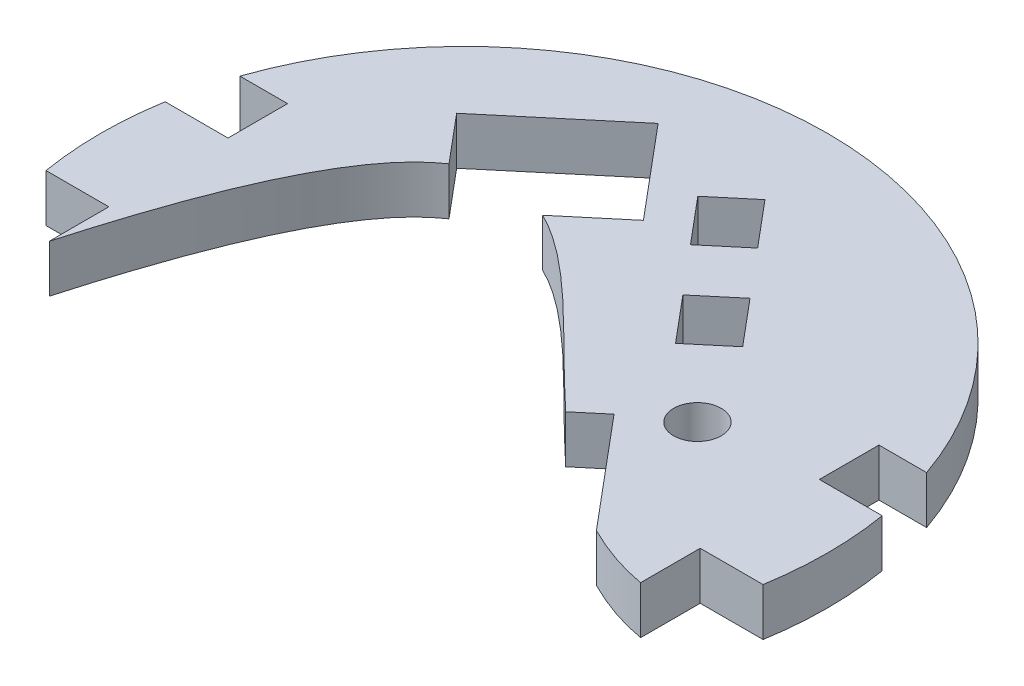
SolidWorks part; units mm, degrees
ref_plane "Alzado" through (0, 0, 0) normal (0, 0, 1) x (1, 0, 0)
ref_plane "Planta" through (0, 0, 0) normal (0, 1, 0) x (1, 0, 0)
ref_plane "Vista lateral" through (0, 0, 0) normal (1, 0, 0) x (0, 0, -1)
sketch "Croquis1" plane through (0, 0, 0) normal (0, 1, 0) x (1, 0, 0)
  circle A0 centre (0, 0) radius 30.5
extrude "Saliente-Extruir1" add sketch "Croquis1" along normal blind 4
sketch "Croquis2" plane through (0, 4, 0) normal (0, 1, 0) x (1, 0, 0)
  circle A0 centre (0, 0) radius 2
extrude "Cortar-Extruir1" cut sketch "Croquis2" against normal blind 4
sketch "Croquis5" plane through (0, 4, 0) normal (0, 1, 0) x (1, 0, 0)
  line L0 (0, 0) -> (0, 10)
  line L1 (28.8141, -5) -> (30.0874, -5)
  line L2 (28.8141, 5) -> (30.0874, 5)
  line L3 (-24.8141, 10) -> (-28.8141, 10)
  line L4 (24.8141, -5) -> (24.8141, -10)
  line L5 (-24.8141, -10) -> (-28.8141, -10)
  line L6 (24.8141, -5) -> (28.8141, -5)
  line L7 (24.8141, 5) -> (24.8141, 10)
  line L8 (-24.8141, 5) -> (-28.8141, 5)
  line L9 (-24.8141, 5) -> (-24.8141, 10)
  line L10 (-24.8141, -5) -> (-28.8141, -5)
  line L11 (-24.8141, -5) -> (-24.8141, -10)
  line L12 (24.8141, 5) -> (28.8141, 5)
  line L13 (24.8141, -10) -> (28.8141, -10)
  line L14 (24.8141, 10) -> (28.8141, 10)
  line L15 (-28.8141, 5) -> (-30.0874, 5)
  line L16 (-28.8141, -5) -> (-30.0874, -5)
  circle A1 centre (0, 0) radius 30.5 construction
  arc A2 (-28.8141, 10) -> (-30.0874, 5) centre (0, 0) ccw
  arc A3 (28.8141, 10) -> (28.8141, -10) centre (0, 0) cw
  arc A4 (-30.0874, -5) -> (-28.8141, -10) centre (0, 0) ccw
  arc A5 (30.0874, -5) -> (28.8141, -10) centre (0, 0) cw
  arc A6 (28.8141, 10) -> (30.0874, 5) centre (0, 0) cw
extrude "Cortar-Extruir3" cut sketch "Croquis5" against normal blind 4
sketch "Croquis7" plane through (0, 4, 0) normal (0, 1, 0) x (1, 0, 0)
  line L0 (-8.1011, 29.1011) -> (9.5756, 8.0348)
  line L2 (-8.1011, 29.1011) -> (-27.2522, 13.0314)
  line L3 (27.2522, -13.0314) -> (8.1011, -29.1011)
  line L4 (8.1011, -29.1011) -> (-27.2522, 13.0314)
  line L5 (2.1944, 23.0542) -> (-0.8697, 20.4831)
  line L6 (2.1944, 23.0542) -> (5.4084, 19.224)
  line L7 (5.4084, 19.224) -> (2.3442, 16.6528)
  line L8 (2.3442, 16.6528) -> (-0.8697, 20.4831)
  line L9 (-24.8141, -10) -> (-28.8141, -10)
  line L10 (24.8141, -10) -> (28.8141, -10)
  line L11 (9.5756, 8.0348) -> (18.4139, -2.4983)
  line L12 (18.4139, -2.4983) -> (27.2522, -13.0314)
  line L13 (11.4555, 1.1272) -> (19.169, -8.0653)
  line L14 (19.169, -8.0653) -> (9.9765, -15.7788)
  line L15 (9.9765, -15.7788) -> (2.263, -6.5863)
  line L16 (11.4555, 1.1272) -> (2.263, -6.5863)
  line L17 (-1.4002, 16.4481) -> (-7.8281, 24.1085)
  line L18 (-1.4002, 16.4481) -> (-10.5927, 8.7346)
  line L19 (-10.5927, 8.7346) -> (-17.0206, 16.3951)
  line L20 (-7.8281, 24.1085) -> (-17.0206, 16.3951)
  arc A1 (-28.8141, -10) -> (28.8141, -10) centre (0, 0) ccw
  circle A2 centre (15.5268, 4.0539) radius 2
  spline S0 degree 3 poles (24.8141, -10) (2.6081, -6.0995) (-10.3265, 41.1093) (-24.8141, -10) knots 0 0 0 0 1 1 1 1
  point P7 (-9.5756, -8.0348)
extrude "Cortar-Extruir5" cut sketch "Croquis7" against normal blind 4
sketch "Croquis9" plane through (0, 4, 0) normal (0, 1, 0) x (1, 0, 0)
  line L0 (-8.3073, 29.3469) -> (22.8679, -7.8063)
  line L2 (8.7375, 15.2565) -> (11.9514, 11.4263)
  line L3 (-8.3073, 29.3469) -> (-21.7131, 18.0981)
  line L4 (-21.7131, 18.0981) -> (9.4621, -19.0551)
  line L5 (9.4621, -19.0551) -> (22.8679, -7.8063)
  line L6 (11.9514, 11.4263) -> (8.8872, 8.8552)
  line L7 (8.7375, 15.2565) -> (5.6733, 12.6854)
  arc A1 (28.8141, 10) -> (-28.8141, 10) centre (0, 0) ccw construction
extrude "Cortar-Extruir6" cut sketch "Croquis9" against normal blind 10 contours L2 L7 L0 L6
